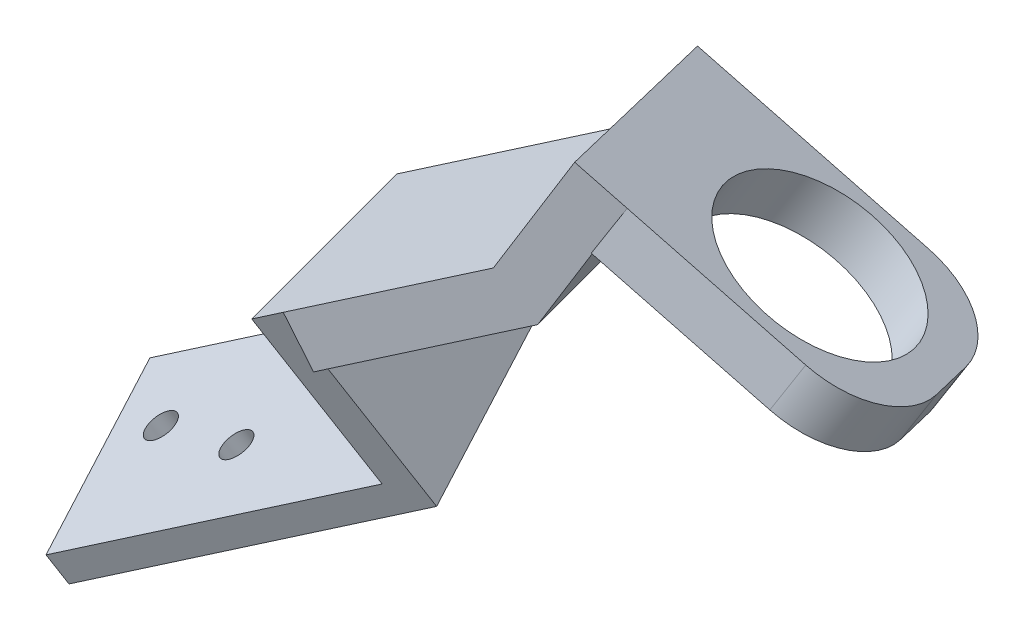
SolidWorks part; units mm, degrees
ref_plane "前视基准面" through (0, 0, 0) normal (0, 0, 1) x (1, 0, 0)
ref_plane "上视基准面" through (0, 0, 0) normal (0, 1, 0) x (1, 0, 0)
ref_plane "右视基准面" through (0, 0, 0) normal (1, 0, 0) x (0, 0, -1)
sketch "草图5" plane through (0, 0, 0) normal (0, 0, 1) x (1, 0, 0)
  line L0 (0, 0) -> (0, 35)
  line L2 (3, 32) -> (3, 0)
  line L3 (3, 0) -> (0, 0)
  line L4 (0, 35) -> (20, 35)
  line L5 (20, 35) -> (20, 32)
  line L6 (20, 32) -> (3, 32)
  dimension "D1" = 90
  dimension "D2" = 3
  dimension "D3" = 20
  dimension "D4" = 3
  dimension "D5" = 35
extrude "凸台-拉伸3" add sketch "草图5" along normal blind 20
sketch "草图6" plane through (0, 0, 0) normal (-1, 0, 0) x (0, 0, 1)
  line L0 (0, 35) -> (0, 0) construction
  line L2 (20, 0) -> (0, 0) construction
  line L4 (20, 35) -> (20, 0) construction
  circle A0 centre (12, 14.1652) radius 1.5
  circle A1 centre (8, 5) radius 1.5
  dimension "D1" = 3
  dimension "D2" = 3
  dimension "D3" = 10
  dimension "D4" = 5
  dimension "D5" = 12
  dimension "D6" = 12
extrude "切除-拉伸3" cut sketch "草图6" against normal blind 20
sketch "草图7" plane through (0, 35, 0) normal (0, 1, 0) x (1, 0, 0)
  line L0 (20, -20) -> (14.641, 0)
  line L1 (20, 0) -> (0, 0) construction
  line L2 (14.641, 0) -> (9.8114, -1.2941)
  line L3 (9.8114, -1.2941) -> (15.1704, -21.2941)
  line L4 (15.1704, -21.2941) -> (20, -20)
  dimension "D1" = 5
  dimension "D2" = 105
extrude "凸台-拉伸4" add sketch "草图7" along normal blind 20
sketch "草图9" plane through (6.3397, 0, 23.6603) normal (0.2588, 0, 0.9659) x (0.9659, 0, -0.2588)
  line L0 (14.1421, 55) -> (26.6421, 76.6506)
  line L1 (26.6421, 76.6506) -> (22.312, 79.1506)
  line L2 (22.312, 79.1506) -> (9.1421, 56.3397)
  line L3 (14.1421, 55) -> (14.1421, 35) construction
  line L4 (9.1421, 55) -> (9.1421, 56.3397)
  line L5 (9.1421, 55) -> (14.1421, 55)
  dimension "D1" = 150
  dimension "D2" = 5
  dimension "D3" = 25
extrude "凸台-拉伸6" add sketch "草图9" against normal up to surface (20.7055 mm away)
sketch "草图10" plane through (-16.9416, 10.1263, 4.5395) normal (-0.8365, 0.5, 0.2241) x (0.1924, -0.115, 0.9746)
  line L0 (15.2326, 70.7684) -> (-4.8048, 64.4004)
  line L1 (13.6944, 82.2493) -> (17.192, 56.1428) construction
  line L2 (-3.3301, 53.3933) -> (-6.8277, 79.4998) construction
  line L3 (-4.8048, 64.4004) -> (-3.2904, 59.6352)
  line L4 (-3.2904, 59.6352) -> (16.747, 66.0033)
  line L5 (16.747, 66.0033) -> (15.2326, 70.7684)
  dimension "D1" = 80
  dimension "D2" = 5
extrude "凸台-拉伸7" add sketch "草图10" along normal blind 25
sketch "草图11" plane through (27.06, 53.5863, -18.546) normal (0.4307, 0.8529, -0.2952) x (0.9025, -0.407, 0.1409)
  line L0 (-13.1691, -21.4369) -> (-28.4496, -50.3083) construction
  circle A0 centre (-20.8093, -35.8726) radius 9
  dimension "D1" = 18
extrude "切除-拉伸4" cut sketch "草图11" against normal blind 22
sketch "草图12" plane through (0, 35, 0) normal (0, 1, 0) x (1, 0, 0)
  line L3 (14.641, 0) -> (20, -20)
  line L4 (20, -20) -> (20, 0)
  line L5 (20, 0) -> (14.641, 0)
  line L6 (14.641, 0) -> (20, -20)
  line L7 (20, -20) -> (20, 0)
  line L8 (20, 0) -> (14.641, 0)
  dimension "D1" = 0
extrude "切除-拉伸5" cut sketch "草图12" against normal blind 22
sketch "草图13" plane through (-16.9416, 10.1263, 4.5395) normal (-0.8365, 0.5, 0.2241) x (0.1924, -0.115, 0.9746)
  line L4 (-6.8277, 79.4998) -> (-4.8048, 64.4004)
  line L5 (-4.8048, 64.4004) -> (15.2326, 70.7684)
  line L6 (15.2326, 70.7684) -> (13.6944, 82.2493)
  line L7 (13.6944, 82.2493) -> (-6.8277, 79.4998)
  line L8 (-6.8277, 79.4998) -> (-4.8048, 64.4004)
  line L9 (-4.8048, 64.4004) -> (15.2326, 70.7684)
  line L10 (15.2326, 70.7684) -> (13.6944, 82.2493)
  line L11 (13.6944, 82.2493) -> (-6.8277, 79.4998)
  dimension "D1" = 0
extrude "切除-拉伸6" cut sketch "草图13" against normal blind 22
mirror "镜向2" about plane through (-37.8545, 22.6263, 10.1431) normal (-0.8365, 0.5, 0.2241)
sketch "草图14" plane through (27.06, 53.5863, -18.546) normal (0.4307, 0.8529, -0.2952) x (0.9025, -0.407, 0.1409)
  line L0 (-36.3412, -30.8206) -> (-28.4496, -50.3083)
  line L1 (-59.5133, -40.2043) -> (-13.1691, -21.4369) construction
  line L2 (-51.6217, -59.692) -> (-5.2775, -40.9246) construction
  line L3 (-28.4496, -50.3083) -> (-22.3469, -65.3783)
  line L4 (-22.3469, -65.3783) -> (34.9997, -42.1555)
  line L5 (34.9997, -42.1555) -> (13.9654, 9.7867)
  line L6 (13.9654, 9.7867) -> (-43.3812, -13.4361)
  line L7 (-43.3812, -13.4361) -> (-36.3412, -30.8206)
extrude "切除-拉伸7" cut sketch "草图14" against normal blind 75
fillet "圆角1" radius 8 2 edges at (0.3075, 79.4869, 25.726) (-6.8148, 76.3251, 6.1985)
